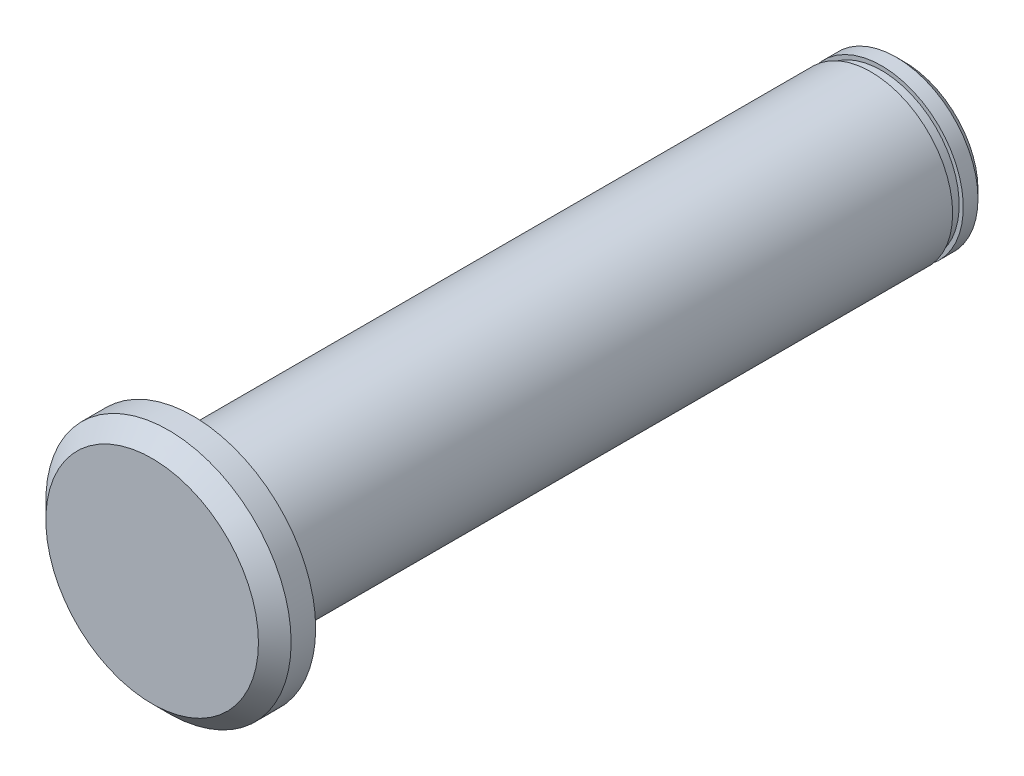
SolidWorks part; units mm, degrees
ref_plane "Plan de face" through (0, 0, 0) normal (0, 0, 1) x (1, 0, 0)
ref_plane "Plan de dessus" through (0, 0, 0) normal (0, 1, 0) x (1, 0, 0)
ref_plane "Plan de droite" through (0, 0, 0) normal (1, 0, 0) x (0, 0, -1)
sketch "Esquisse1" plane through (0, 0, 0) normal (0, 0, 1) x (1, 0, 0)
  circle A0 centre (0, 0) radius 10
  dimension "D1" = 20
extrude "Extrusion1" add sketch "Esquisse1" along normal blind 87
sketch "Esquisse2" plane through (0, 0, 87) normal (0, 0, 1) x (1, 0, 0)
  circle A0 centre (0, 0) radius 15
  dimension "D1" = 30
extrude "Extrusion2" add sketch "Esquisse2" along normal blind 5
chamfer "Chanfrein1" distance 2 angle 45 1 edges at (15, 0, 92)
sketch "Esquisse3" plane through (0, 0, 0) normal (1, 0, 0) x (0, 0, -1)
  line L0 (0, 0) -> (-38.1908, 0) construction
  line L1 (-4.1, 13.8107) -> (-2.8, 13.8107)
  line L2 (-4.1, 13.8107) -> (-4.1, 9.5)
  line L3 (-4.1, 9.5) -> (-2.8, 9.5)
  line L4 (-2.8, 13.8107) -> (-2.8, 9.5)
  line L5 (-87, -15) -> (-87, 15) construction
  dimension "D1" = 84.2
  dimension "D2" = 1.3
  dimension "D3" = 9.5
revolve "Enlèvement de matière-Révolution1" cut sketch "Esquisse3" angle 360 about L0
chamfer "Chanfrein2" distance 1 angle 45 1 edges at (10, 0, 0)
